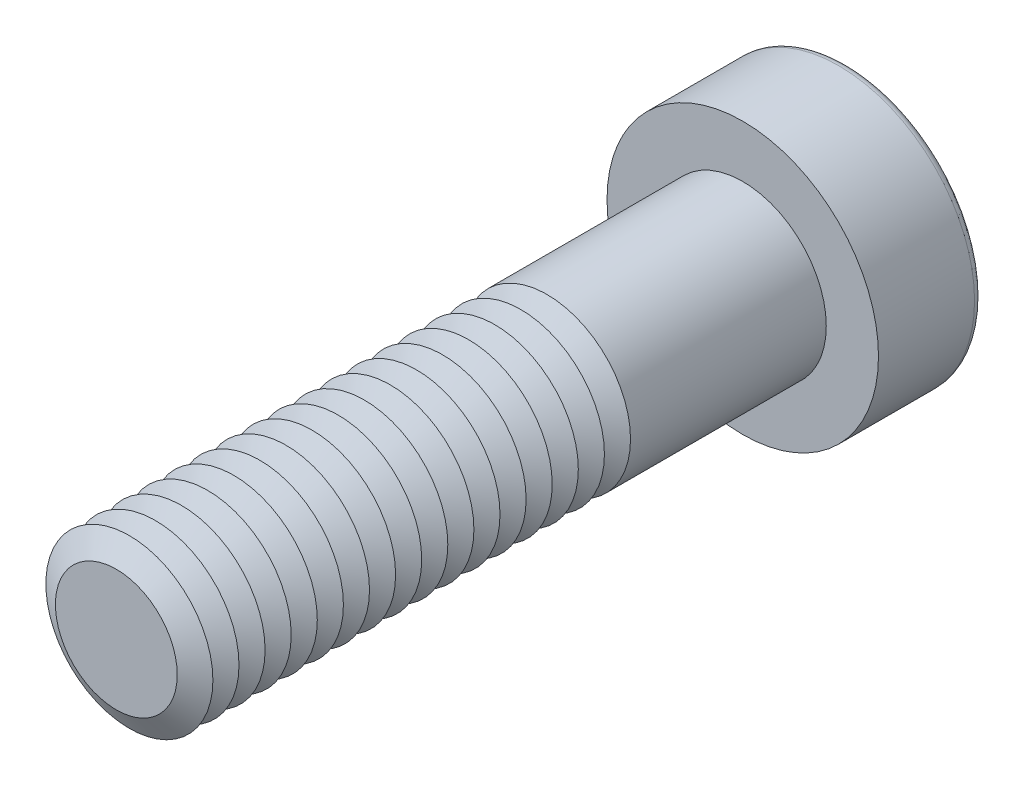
SolidWorks part; units mm, degrees
ref_plane "Front Plane" through (0, 0, 0) normal (0, 0, 1) x (1, 0, 0)
ref_plane "Top Plane" through (0, 0, 0) normal (0, 1, 0) x (1, 0, 0)
ref_plane "Right Plane" through (0, 0, 0) normal (1, 0, 0) x (0, 0, -1)
sketch "Sketch1" plane through (0, 0, 0) normal (0, 0, 1) x (1, 0, 0)
  circle A0 centre (0, 0) radius 4
  dimension "D1" = 8
extrude "Boss-Extrude1" add sketch "Sketch1" along normal blind 30
sketch "Sketch2" plane through (0, 0, 0) normal (0, 0, -1) x (-1, 0, 0)
  circle A0 centre (0, 0) radius 6.5
  dimension "D1" = 13
extrude "Boss-Extrude2" add sketch "Sketch2" along normal blind 5
sketch "Sketch3" plane through (0, 0, -5) normal (0, 0, -1) x (-1, 0, 0)
  line L1 (-1.4434, 2.5) -> (-2.8868, 0)
  line L2 (-2.8868, 0) -> (-1.4434, -2.5)
  line L3 (-1.4434, -2.5) -> (1.4434, -2.5)
  line L4 (1.4434, -2.5) -> (2.8868, 0)
  line L5 (2.8868, 0) -> (1.4434, 2.5)
  line L6 (1.4434, 2.5) -> (-1.4434, 2.5)
  circle A0 centre (0, 0) radius 2.5 construction
  dimension "D1" = 5
extrude "Cut-Extrude1" cut sketch "Sketch3" against normal blind 3.75
fillet "Fillet1" radius 0.4 1 edges at (-6.5, 0, -5)
sketch "Sketch4" plane through (0, 0, -1.25) normal (0, 0, -1) x (-1, 0, 0)
  line L0 (1.4434, -2.5) -> (2.8868, 0) construction
  circle A0 centre (0, 0) radius 2.5
extrude "Cut-Extrude2" cut sketch "Sketch4" against normal through all draft 60
sketch "Sketch5" plane through (0, 0, -5) normal (0, 0, -1) x (-1, 0, 0)
  circle A0 centre (0, 0) radius 2.8868
extrude "Cut-Extrude3" cut sketch "Sketch5" against normal through all draft 75
sketch "Sketch7" plane through (0, 0, 0) normal (1, 0, 0) x (0, 0, -1)
  line L25 (-30, 2.9175) -> (-29.375, 4)
  line L26 (-30, 4) -> (-30, -4) construction
  line L27 (-29.375, 4) -> (-30.625, 4)
  line L28 (-30.625, 4) -> (-30, 2.9175)
  line L29 (0, 4) -> (-30, 4) construction
  dimension "D1" = 1.25
revolve "Cut-Revolve1" cut sketch "Sketch7" angle 360 about axis through (0, 0, 30) along (0, 0, -1)
pattern_linear "LPattern1" count 17 spacing 1.25 along (0, 0, -1) of "Cut-Revolve1"
